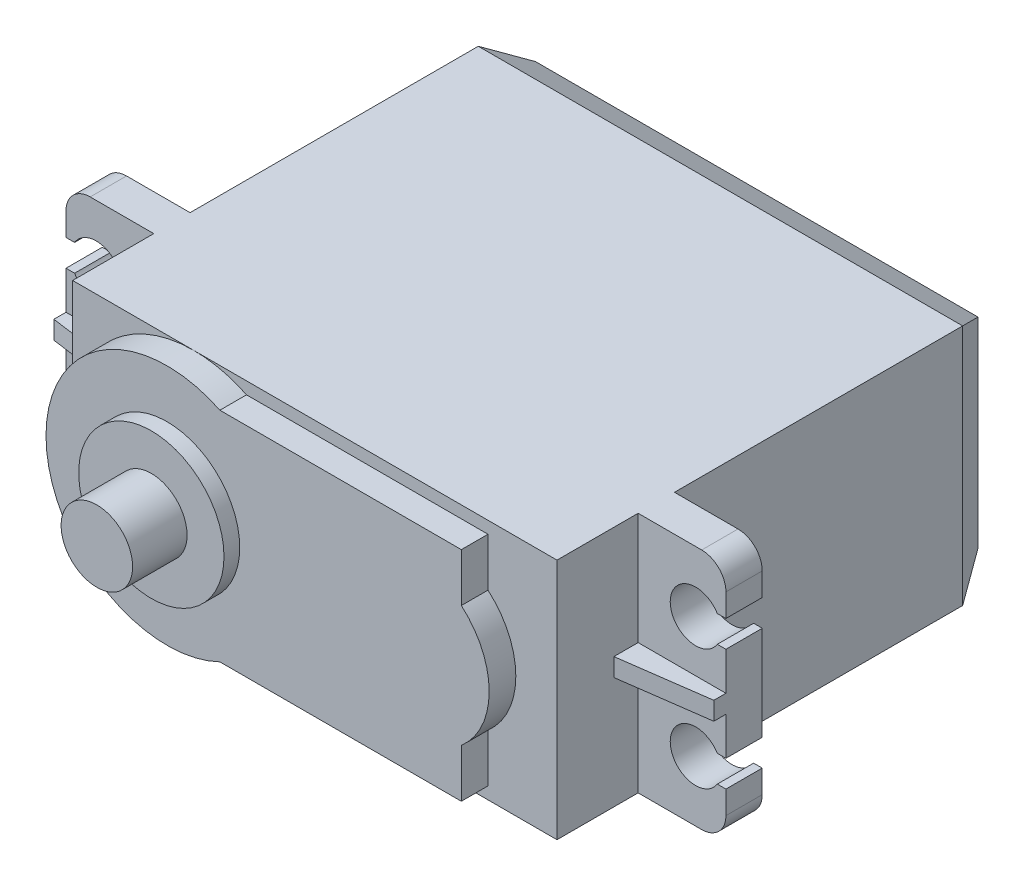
SolidWorks part; units mm, degrees
ref_plane "Plan de face" through (0, 0, 0) normal (0, 0, 1) x (1, 0, 0)
ref_plane "Plan de dessus" through (0, 0, 0) normal (0, 1, 0) x (1, 0, 0)
ref_plane "Plan de droite" through (0, 0, 0) normal (1, 0, 0) x (0, 0, -1)
sketch "Esquisse1" plane through (0, 0, 0) normal (0, 0, 1) x (1, 0, 0)
  line L1 (20, -10) -> (-20, -10)
  line L2 (20, -10) -> (20, 10)
  line L3 (20, 10) -> (-20, 10)
  line L4 (-20, -10) -> (-20, 10)
  line L5 (20, -10) -> (-20, 10) construction
  line L6 (20, 10) -> (-20, -10) construction
  point P0 (0, 0)
  dimension "D1" = 20
  dimension "D2" = 40
extrude "Boss.-Extru.1" add sketch "Esquisse1" along normal blind 36.5
ref_plane "Plan1" through (0, 0, 26.8) normal (0, 0, -1) x (-1, 0, 0)
sketch "Esquisse2" plane through (0, 0, 26.8) normal (0, 0, -1) x (-1, 0, 0)
  line L0 (-20, 0) -> (-31.0717, 0) construction
  line L1 (-20, 10) -> (-27.25, 10)
  line L2 (-20, 10) -> (-20, -10)
  line L3 (-20, -10) -> (-27.25, -10)
  line L4 (-27.25, 10) -> (-27.25, 6.1)
  line L5 (-24.75, 5) -> (-24.75, -5) construction
  line L6 (-27.25, 6.1) -> (-26.5389, 6.1)
  line L7 (-27.25, 3.9) -> (-26.5389, 3.9)
  line L8 (-27.25, -3.9) -> (-26.5389, -3.9)
  line L9 (-27.25, -6.1) -> (-26.5389, -6.1)
  line L10 (-27.25, 3.9) -> (-27.25, -3.9)
  line L11 (-27.25, -6.1) -> (-27.25, -10)
  line L12 (0, 0) -> (0, 16.2218) construction
  line L13 (20, -10) -> (27.25, -10)
  line L14 (27.25, -6.1) -> (27.25, -10)
  line L15 (27.25, -3.9) -> (26.5389, -3.9)
  line L16 (27.25, 3.9) -> (27.25, -3.9)
  line L17 (27.25, 3.9) -> (26.5389, 3.9)
  line L18 (27.25, 6.1) -> (26.5389, 6.1)
  line L19 (27.25, 10) -> (27.25, 6.1)
  line L20 (20, 10) -> (27.25, 10)
  line L21 (20, 10) -> (20, -10)
  line L22 (27.25, -6.1) -> (26.5389, -6.1)
  arc A0 (-26.5389, 3.9) -> (-26.5389, 6.1) centre (-24.75, 5) ccw
  arc A1 (-26.5389, -6.1) -> (-26.5389, -3.9) centre (-24.75, -5) ccw
  arc A2 (26.5389, -6.1) -> (26.5389, -3.9) centre (24.75, -5) cw
  arc A3 (26.5389, 3.9) -> (26.5389, 6.1) centre (24.75, 5) cw
  dimension "D3" = 10
  dimension "D4" = 4.75
  dimension "D5" = 4.2
  dimension "D6" = 4.2
  dimension "D1" = 7.25
  dimension "D2" = 5
  dimension "D7" = 2.2
  dimension "D8" = 1.1
  dimension "D9" = 1.1
  dimension "D10" = 2.2
extrude "Boss.-Extru.2" add sketch "Esquisse2" against normal blind 3
fillet "Congé1" radius 2 4 edges at (-27.25, 10, 28.3) (27.25, 10, 28.3) (-27.25, -10, 28.3) (27.25, -10, 28.3)
ref_plane "Plan2" through (0, 0, 0) normal (0, 1, 0) x (1, 0, 0)
sketch "Esquisse3" plane through (0, 0, 0) normal (0, 1, 0) x (1, 0, 0)
  line L0 (-27.25, -29.8) -> (-27.25, -30.8)
  line L1 (-27.25, -30.8) -> (-20, -31.8)
  line L3 (-20, -31.8) -> (-20, -29.8)
  line L4 (-20, -29.8) -> (-27.25, -29.8)
  line L5 (0, 0) -> (0, -16.7794) construction
  line L6 (27.25, -30.8) -> (20, -31.8)
  line L7 (20, -31.8) -> (20, -29.8)
  line L8 (20, -29.8) -> (27.25, -29.8)
  line L9 (27.25, -29.8) -> (27.25, -30.8)
  dimension "D1" = 2
  dimension "D2" = 1
extrude "Boss.-Extru.3" add sketch "Esquisse3" along normal blind 0.75 and the other way blind 0.75
chamfer "Chanfrein1" distance 3 angle 30 4 edges at (0, -10, 0) (20, 0, 0) (0, 10, 0) (-20, 0, 0)
sketch "Esquisse4" plane through (0, 0, 36.5) normal (0, 0, 1) x (1, 0, 0)
  line L0 (-20, 10) -> (-20, -10) construction
  line L1 (20, -10) -> (20, 10) construction
  line L2 (-5.6411, 9) -> (14.3, 9)
  line L3 (18.425, 0) -> (-18.425, 0) construction
  line L4 (-5.6411, -9) -> (14.3, -9)
  line L5 (14.3, 9) -> (14.3, 5)
  line L6 (14.3, -5) -> (14.3, -9)
  arc A0 (-5.6411, 9) -> (-5.6411, -9) centre (-10, 0) ccw
  arc A1 (14.3, -5) -> (14.3, 5) centre (10.0152, 0) ccw
  point P2 (16.6, 0)
  point P4 (14.3, 5)
  point P14 (14.3, -5)
  dimension "D1" = 18
  dimension "D2" = 9
  dimension "D3" = 5.7
  dimension "D4" = 2.3
  dimension "D5" = 5
  dimension "D6" = 5
extrude "Boss.-Extru.4" add sketch "Esquisse4" along normal blind 2.2
sketch "Esquisse6" plane through (0, 0, 38.7) normal (0, 0, 1) x (1, 0, 0)
  circle A0 centre (-10, 0) radius 6
  dimension "D1" = 12
extrude "Boss.-Extru.5" add sketch "Esquisse6" along normal blind 1.3
sketch "Esquisse7" plane through (0, 0, 40) normal (0, 0, 1) x (1, 0, 0)
  circle A0 centre (-10, 0) radius 2.95
  dimension "D1" = 5.9
extrude "Boss.-Extru.6" add sketch "Esquisse7" along normal blind 4.5
equation "\"D6@Esquisse2\"=\"D5@Esquisse2\""
